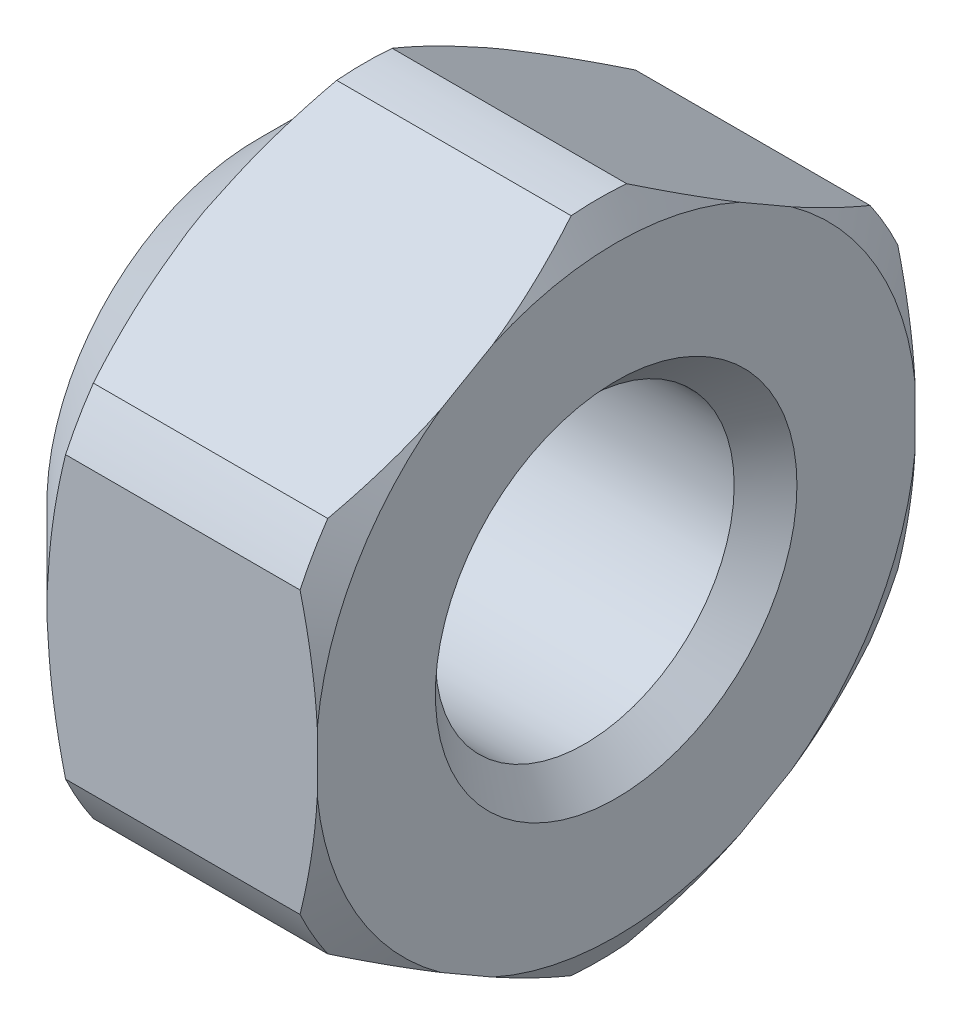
SolidWorks part; units mm, degrees
ref_plane "Ebene vorne" through (0, 0, 0) normal (0, 0, 1) x (1, 0, 0)
ref_plane "Ebene oben" through (0, 0, 0) normal (0, 1, 0) x (1, 0, 0)
ref_plane "Ebene rechts" through (0, 0, 0) normal (1, 0, 0) x (0, 0, -1)
sketch "Skizze1" plane through (0, 0, 0) normal (0, 0, 1) x (1, 0, 0)
  line L0 (0, 0) -> (-7.1624, 0) construction
  line L1 (0, 0) -> (0, 5.525)
  line L2 (0, 5.525) -> (-4.5, 5.525)
  line L3 (-4.5, 5.525) -> (-4.5, 5.025)
  line L4 (-4.5, 5.025) -> (-6, 3.525)
  line L5 (-6, 3.525) -> (-6, 0)
  line L6 (-6, 0) -> (0, 0)
  dimension "D1" = 11.05
  dimension "D2" = 4.5
  dimension "D3" = 6
  dimension "D4" = 135
  dimension "D5" = 0.5
revolve "Rotation1" add sketch "Skizze1" angle 360 about L0
chamfer "Fase1" distance 0.5 angle 30 2 edges at (0, 0, -5.525) (-4.5, 0, -5.525)
sketch "Skizze2" plane through (0, 0, 0) normal (1, 0, 0) x (0, 0, -1)
  line L1 (0, 5.7735) -> (-5, 2.8868)
  line L2 (-5, 2.8868) -> (-5, -2.8868)
  line L3 (-5, -2.8868) -> (0, -5.7735)
  line L4 (0, -5.7735) -> (5, -2.8868)
  line L5 (5, -2.8868) -> (5, 2.8868)
  line L6 (5, 2.8868) -> (0, 5.7735)
  circle A0 centre (0, 0) radius 5 construction
  circle A1 centre (0, 0) radius 6
  dimension "D2" = 12
  dimension "D1" = 10
extrude "Schnitt-Linear austragen1" cut sketch "Skizze2" against normal through all
hole_wizard "M6 Gewindebohrung1" positions "Skizze3" profile "Skizze5" tap size "M6" standard "DIN"
sketch "Skizze3" plane through (0, 0, 0) normal (1, 0, 0) x (0, 0, -1)
  point P0 (0, 0)
sketch "Skizze5" plane through (0, 0, 0) normal (0, 1, 0) x (0, 0, -1)
  line L0 (0, 0) -> (0, 6)
  line L1 (0, 6) -> (3.025, 6)
  line L2 (2.5, 5.475) -> (2.5, 0.525)
  line L3 (2.5, 0.525) -> (3.025, 0)
  line L5 (3.025, 0) -> (0, 0)
  line L6 (-2.5, 0.525) -> (-3.025, 0) construction
  line L7 (3.025, 6) -> (2.5, 5.475)
  line L8 (-3.025, 6) -> (-2.5, 5.475) construction
  line L11 (0, -6.35) -> (0, 107.95) construction
  dimension "Bohrerdurchmesser" = 5
  dimension "Bohrungstiefe" = 6
  dimension "Senkdurchmesser (Oben)" = 6.05
  dimension "Senkwinkel (Oben)" = 90
  dimension "Senkdurchmesser (Unten)" = 6.05
  dimension "Senkwinkel (Unten)" = 90
